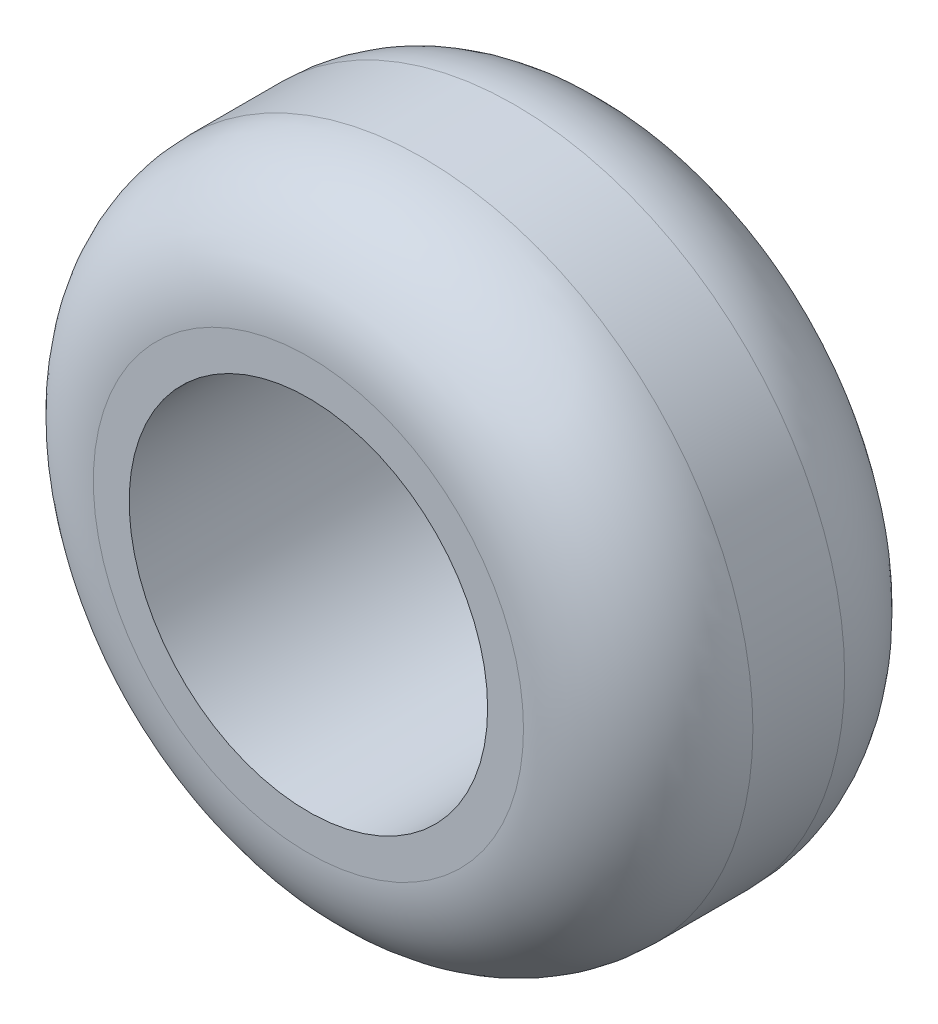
SolidWorks part; units mm, degrees
ref_plane "Plan1" through (0, 0, 0) normal (0, 0, 1) x (1, 0, 0)
ref_plane "Plan2" through (0, 0, 0) normal (0, 1, 0) x (1, 0, 0)
ref_plane "Plan3" through (0, 0, 0) normal (1, 0, 0) x (0, 0, -1)
sketch "Esquisse1" plane through (0, 0, 0) normal (0, 0, 1) x (1, 0, 0)
  circle A0 centre (0, 0) radius 62.5
  circle A1 centre (0, 0) radius 115
  dimension "D1" = 125
  dimension "D2" = 230
extrude "Base-Extrusion" add sketch "Esquisse1" along normal blind 112
fillet "Congé1" radius 40
